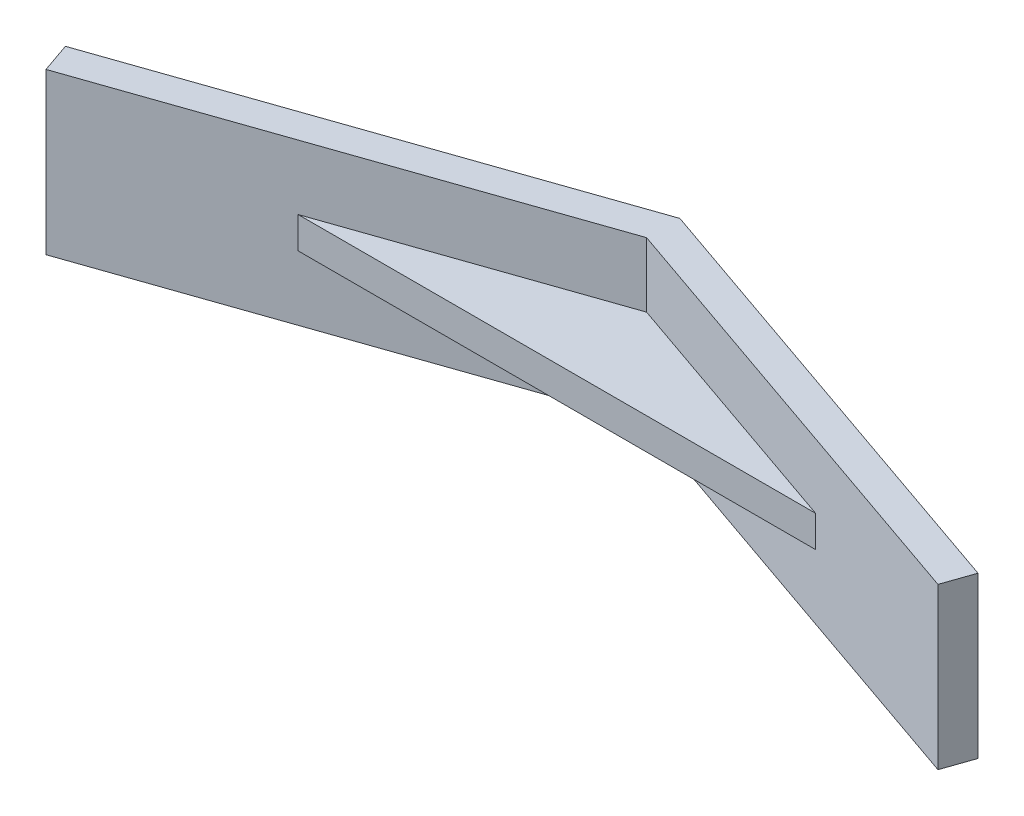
SolidWorks part; units mm, degrees
ref_plane "Alzado" through (0, 0, 0) normal (0, 0, 1) x (1, 0, 0)
ref_plane "Planta" through (0, 0, 0) normal (0, 1, 0) x (1, 0, 0)
ref_plane "Vista lateral" through (0, 0, 0) normal (1, 0, 0) x (0, 0, -1)
sketch "Croquis2" plane through (0, 0, 0) normal (0, 1, 0) x (1, 0, 0)
  line L0 (0, 155.8767) -> (0, -155.8767) construction
  line L1 (-289.4925, 0) -> (289.4925, 0) construction
  line L2 (-141.7254, 0) -> (0, 49.1315)
  line L3 (0, 59.7153) -> (-145.0009, 9.4484)
  line L5 (141.7254, 0) -> (0, 49.1315)
  line L6 (0, 59.7153) -> (145.0009, 9.4484)
  line L8 (141.7254, 0) -> (145.0009, 9.4484)
  line L9 (-141.7254, 0) -> (-145.0009, 9.4484)
  point P4 (0, 0)
  point P8 (0, 0)
  dimension "D1" = 150
  dimension "D2" = 19.12
  dimension "D3" = 10
extrude "Saliente-Extruir1" add sketch "Croquis2" along normal mid plane 51
sketch "Croquis3" plane through (0, 0, 0) normal (0, 1, 0) x (1, 0, 0)
  line L0 (-82.232, 20.6244) -> (82.232, 20.6244)
  line L1 (-141.7254, 0) -> (0, 49.1315) construction
  line L2 (0, 49.1315) -> (141.7254, 0) construction
rib "Nervio1" sketch "Croquis3" sketch "Croquis3" thickness 10 extrusion direction parallel to sketch draft on no parameters "D1"=10
